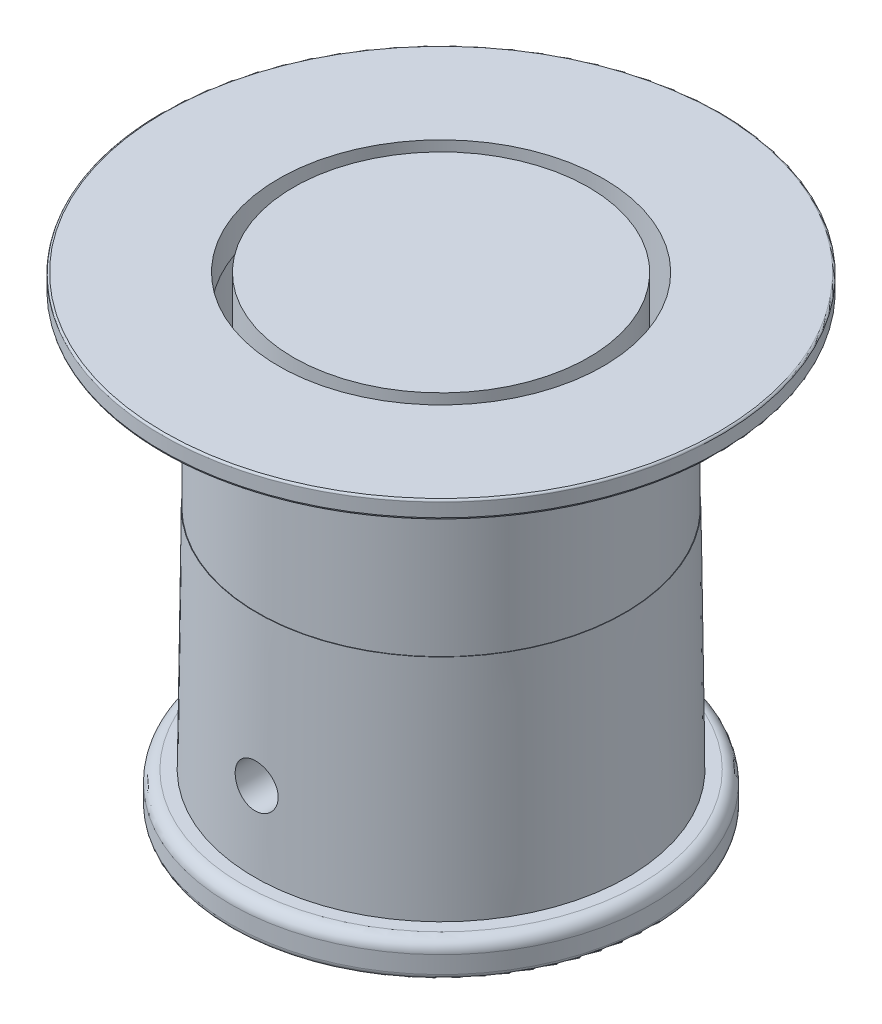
SolidWorks part; units mm, degrees
ref_plane "Front Plane" through (0, 0, 0) normal (0, 0, 1) x (1, 0, 0)
ref_plane "Top Plane" through (0, 0, 0) normal (0, 1, 0) x (1, 0, 0)
ref_plane "Right Plane" through (0, 0, 0) normal (1, 0, 0) x (0, 0, -1)
ref_plane "Plane2" through (0, 58.42, 0) normal (0, 1, 0) x (-1, 0, 0)
sketch "Sketch1" plane through (0, 0, 0) normal (0, 1, 0) x (1, 0, 0)
  circle A0 centre (0, 0) radius 28.575
  dimension "D1" = 57.15
extrude "BOTTOM RIM" add sketch "Sketch1" along normal blind 4.699
fillet "BOTTOM RIM TOP FILLET" radius 1.5748 1 edges at (0, 4.699, 28.575)
sketch "Sketch4" plane through (0, 0, 0) normal (0, 0, 1) x (1, 0, 0)
  line L0 (0, 4.699) -> (0, 35.56)
  line L1 (0, -31.4325) -> (0, 31.4325) construction
  line L2 (27.0002, 4.699) -> (-27.0002, 4.699) construction
  line L3 (0, 35.56) -> (-24.9555, 35.56)
  line L4 (-24.9555, 35.56) -> (-25.3365, 4.699)
  line L5 (-25.3365, 4.699) -> (0, 4.699)
  line L7 (0, -1.9552) -> (0, 47.5895) construction
  line L8 (-28.575, 0) -> (28.575, 0) construction
  point P12 (-24.9555, 35.56)
  dimension "D1" = 35.56
  dimension "D2" = 24.9555
  dimension "D4" = 25.3365
ref_axis "CENTER AXIS" through (0, 47.5895, 0) along (0, -1, 0)
revolve "BODY" add sketch "Sketch4" angle 360 about L7
sketch "Sketch5" plane through (0, 35.56, 0) normal (0, 1, 0) x (-1, 0, 0)
  circle A0 centre (0, 0) radius 9.3472
  dimension "D1" = 18.6944
extrude "CENTER DIA LG" cut sketch "Sketch5" against normal blind 30.861
sketch "Sketch7" plane through (0, 35.56, 0) normal (0, 1, 0) x (-1, 0, 0)
  circle A0 centre (0, 0) radius 22.6822
  circle A1 centre (0, 0) radius 11.6205
  dimension "D1" = 45.3644
  dimension "D2" = 23.241
extrude "INSIDE DIA CUT" cut sketch "Sketch7" against normal blind 30.861
fillet "BOTTOM RIM BOT FILLET" radius 0.7874 1 edges at (0, 0, 28.575)
sketch "Sketch8" plane through (0, 35.56, 0) normal (0, 1, 0) x (-1, 0, 0)
  line L0 (1.524, -22.6309) -> (1.524, -11.5201)
  line L1 (-1.524, -22.6309) -> (-1.524, -11.5201)
  line L2 (0, 0) -> (0, -34.4302) construction
  line L3 (0, 31.4325) -> (0, -31.4325) construction
  line L4 (-22.6309, 1.524) -> (-11.5201, 1.524)
  line L5 (-22.6309, -1.524) -> (-11.5201, -1.524)
  line L6 (1.524, 22.6309) -> (1.524, 11.5201)
  line L7 (-1.524, 22.6309) -> (-1.524, 11.5201)
  line L8 (22.6309, -1.524) -> (11.5201, -1.524)
  line L9 (22.6309, 1.524) -> (11.5201, 1.524)
  circle A0 centre (0, 0) radius 11.6205 construction
  arc A1 (-1.524, -11.5201) -> (1.524, -11.5201) centre (0, 0) ccw
  circle A2 centre (0, 0) radius 22.6822 construction
  arc A3 (-1.524, -22.6309) -> (1.524, -22.6309) centre (0, 0) ccw
  arc A4 (-22.6309, 1.524) -> (-22.6309, -1.524) centre (0, 0) ccw
  arc A5 (-11.5201, 1.524) -> (-11.5201, -1.524) centre (0, 0) ccw
  arc A6 (1.524, 22.6309) -> (-1.524, 22.6309) centre (0, 0) ccw
  arc A7 (1.524, 11.5201) -> (-1.524, 11.5201) centre (0, 0) ccw
  arc A8 (22.6309, -1.524) -> (22.6309, 1.524) centre (0, 0) ccw
  arc A9 (11.5201, -1.524) -> (11.5201, 1.524) centre (0, 0) ccw
  dimension "D1" = 3.048
extrude "RIBS" add sketch "Sketch8" against normal up to surface (30.861 mm away)
sketch "Sketch9" plane through (0, 4.699, 0) normal (0, 1, 0) x (-1, 0, 0)
  line L0 (1.524, -9.2221) -> (1.524, -5.0457)
  line L1 (4.1148, 2.6019) -> (4.1148, 22.3058)
  line L2 (-1.524, -9.2221) -> (-1.524, -5.0457)
  line L3 (0, 0) -> (0, 35.6134) construction
  line L4 (1.524, -22.6309) -> (1.524, -11.5201) construction
  line L5 (-1.524, -11.5201) -> (-1.524, -22.6309) construction
  line L6 (0, 31.4325) -> (0, -31.4325) construction
  line L7 (-4.1148, 2.6019) -> (-4.1148, 22.3058)
  arc A0 (1.9835, -4.3298) -> (4.2067, 2.2327) centre (0, 0) ccw
  circle A2 centre (0, 0) radius 9.3472 construction
  arc A3 (1.524, -5.0457) -> (1.9835, -4.3298) centre (2.3114, -5.0457) cw
  arc A4 (-1.9835, -4.3298) -> (-1.524, -5.0457) centre (-2.3114, -5.0457) cw
  arc A5 (-1.524, -9.2221) -> (1.524, -9.2221) centre (0, 0) ccw
  arc A6 (-1.524, 22.6309) -> (-22.6309, 1.524) centre (0, 0) ccw construction
  arc A7 (22.6309, 1.524) -> (1.524, 22.6309) centre (0, 0) ccw construction
  arc A8 (-4.2067, 2.2327) -> (-1.9835, -4.3298) centre (0, 0) ccw
  arc A9 (4.1148, 2.6019) -> (4.2067, 2.2327) centre (4.9022, 2.6019) ccw
  arc A10 (-4.1148, 2.6019) -> (-4.2067, 2.2327) centre (-4.9022, 2.6019) cw
  arc A11 (4.1148, 22.3058) -> (-4.1148, 22.3058) centre (0, 0) ccw
  dimension "D1" = 9.525
  dimension "D2" = 0.7874
  dimension "D4" = 0.7874
  dimension "D3" = 8.2296
extrude "CENTRAL CROSS RIB W/HOLE" add sketch "Sketch9" along normal blind 14.7828
sketch "Sketch10" plane through (0, 19.4818, 0) normal (0, 1, 0) x (-1, 0, 0)
  circle A0 centre (0, 0) radius 2.4765
  dimension "D1" = 4.953
extrude "CENTER DIA SMALL" cut sketch "Sketch10" against normal blind 9.906
sketch "Sketch11" plane through (0, 0, 0) normal (0, 0, 1) x (1, 0, 0)
  line L0 (0, -31.4325) -> (0, 31.4325) construction
  line L1 (0, 4.699) -> (0, 35.56) construction
  line L3 (22.6309, 35.56) -> (1.524, 35.56) construction
  point P0 (0, 15.367)
  dimension "D1" = 20.193
ref_plane "Plane1" through (0, 0, 25.1714) normal (0, 0, 1) x (1, 0, 0)
sketch "Sketch14" plane through (0, 0, 25.1714) normal (0, 0, 1) x (1, 0, 0)
  circle A0 centre (0, 15.367) radius 2.921
  dimension "D1" = 5.842
extrude ".23 DIA" cut sketch "Sketch14" against normal blind 10.4394 and the other way blind 11.684
hole_wizard "#8-32 Tapped Hole1" positions "Sketch17" profile "Sketch16" tap size "#8-32" standard "Ansi Inch"
sketch "Sketch17" plane through (0, 0, 14.732) normal (0, 0, 1) x (1, 0, 0)
  point P0 (0, 15.367)
sketch "Sketch16" plane through (0, 15.367, 14.732) normal (1, 0, 0) x (0, -1, 0)
  line L0 (0, 0) -> (0, 12.2555)
  line L1 (0, 12.2555) -> (1.7272, 12.2555)
  line L2 (1.7272, 12.2555) -> (1.7272, 0)
  line L5 (1.7272, 0) -> (0, 0)
  line L11 (0, -6.35) -> (0, 107.95) construction
  dimension "Thru Tap Drill Dia." = 3.4544
  dimension "Thru Tap Drill Depth" = 12.2555
sketch "Sketch18" plane through (0, 0, 0) normal (0, 0, 1) x (1, 0, 0)
  line L0 (-22.6309, 4.699) -> (-22.6309, 35.56) construction
  line L1 (-22.6309, 4.699) -> (-22.6309, 35.56)
  line L2 (-4.1148, 4.699) -> (-22.6309, 4.699) construction
  line L3 (-22.3008, 4.699) -> (-22.6309, 4.699)
  line L4 (-22.6309, 35.56) -> (-22.3008, 4.699)
  dimension "D1" = 0.613
revolve "Revolve1" add sketch "Sketch18" angle 360 about axis through (0, 47.5895, 0) along (0, -1, 0)
sketch "Sketch19" plane through (0, 0, 25.1714) normal (0, 0, 1) x (1, 0, 0)
  circle A0 centre (0, 15.367) radius 2.921 construction
  circle A1 centre (0, 15.367) radius 2.921
extrude "Cut-Extrude1" cut sketch "Sketch19" against normal blind 3.81
sketch "Sketch20" plane through (0, 0, 0) normal (0, 0, 1) x (1, 0, 0)
  line L0 (22.6309, 35.56) -> (1.524, 35.56) construction
  line L1 (-22.0472, 35.56) -> (-24.892, 35.56)
  line L2 (-24.892, 35.56) -> (-24.892, 60.398)
  line L3 (0, 15.367) -> (0, 74.783) construction
  line L4 (0, 47.5895) -> (0, -1.9552) construction
  line L5 (-25.2889, 60.7949) -> (-37.592, 60.7949)
  line L6 (-37.846, 61.0489) -> (-37.846, 62.8904)
  line L7 (-37.592, 63.1444) -> (-22.0472, 63.1444)
  line L8 (-22.0472, 63.1444) -> (-22.0472, 35.56)
  arc A0 (-37.846, 61.0489) -> (-37.592, 60.7949) centre (-37.592, 61.0489) ccw
  arc A1 (-37.592, 63.1444) -> (-37.846, 62.8904) centre (-37.592, 62.8904) ccw
  arc A2 (-24.892, 60.398) -> (-25.2889, 60.7949) centre (-25.2889, 60.398) ccw
  point P16 (-37.846, 60.7949)
  point P19 (-37.846, 63.1444)
  dimension "D5" = 0.254
  dimension "D6" = 0.3969
  dimension "D1" = 24.892
  dimension "D2" = 27.5844
  dimension "D3" = 2.3495
  dimension "D4" = 37.846
  dimension "D7" = 2.8448
revolve "Revolve4" add sketch "Sketch20" angle 360 about L3
sketch "Sketch21" plane through (0, 58.42, 0) normal (0, 1, 0) x (1, 0, 0)
  line L0 (0, 0) -> (30.1934, 0) construction
  line L1 (15.5897, 15.5897) -> (15.8053, 15.8053)
  line L2 (15.5897, -15.5897) -> (15.8053, -15.8053)
  line L3 (0, 0) -> (0, 42.0286) construction
  line L4 (-15.5897, -15.5897) -> (-15.8053, -15.8053)
  line L5 (-15.5897, 15.5897) -> (-15.8053, 15.8053)
  arc A0 (15.8053, -15.8053) -> (15.8053, 15.8053) centre (0, 0) ccw
  circle A1 centre (0, 0) radius 22.0472 construction
  arc A2 (15.5897, -15.5897) -> (15.5897, 15.5897) centre (0, 0) ccw
  arc A3 (-15.5897, -15.5897) -> (-15.5897, 15.5897) centre (0, 0) cw
  arc A4 (-15.8053, -15.8053) -> (-15.8053, 15.8053) centre (0, 0) cw
  dimension "D1" = 44.704
  dimension "D2" = 45
extrude "Cut-Extrude2" cut sketch "Sketch21" against normal up to surface (22.86 mm away)
ref_plane "Plane3" through (0, 45.72, 0) normal (0, 1, 0) x (-1, 0, 0)
sketch "Sketch22" plane through (0, 45.72, 0) normal (0, 1, 0) x (-1, 0, 0)
  arc A0 (15.8053, -15.8053) -> (15.8053, 15.8053) centre (0, 0) ccw construction
  circle A1 centre (0, 0) radius 22.352
extrude "Cut-Extrude3" cut sketch "Sketch22" against normal up to surface (10.16 mm away)
sketch "Sketch23" plane through (0, 63.1444, 0) normal (0, 1, 0) x (1, 0, 0)
  circle A0 centre (0, 0) radius 20.0363
extrude "Extrude1" add sketch "Sketch23" against normal blind 19.05
